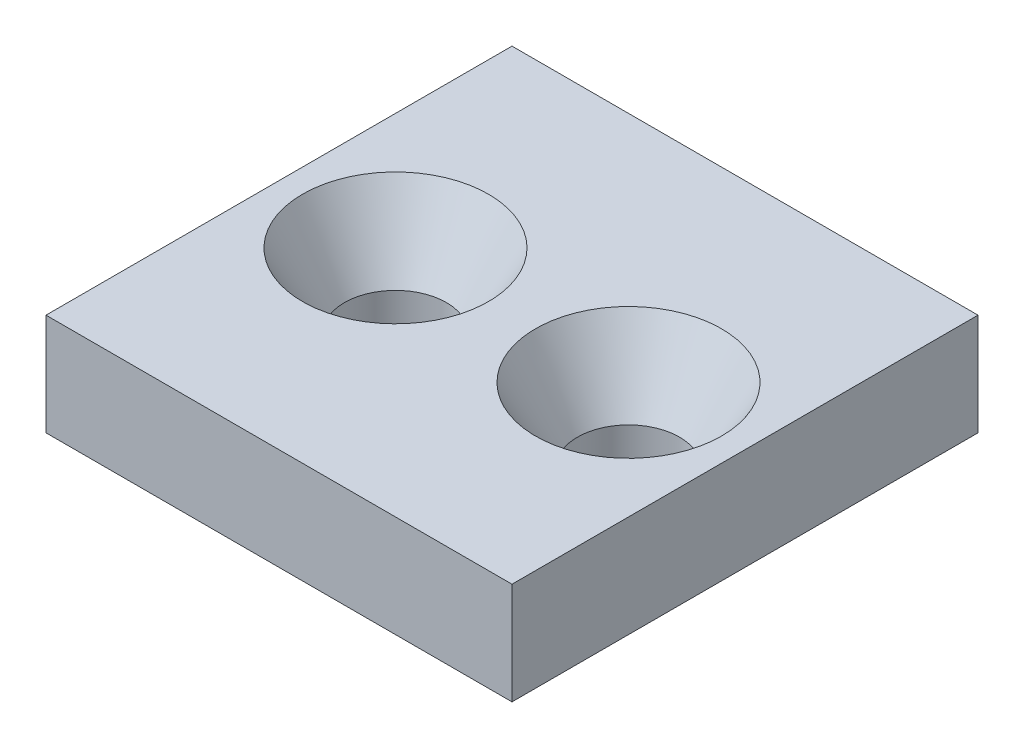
SolidWorks part; units mm, degrees
ref_plane "Front" through (0, 0, 0) normal (0, 0, 1) x (1, 0, 0)
ref_plane "Top" through (0, 0, 0) normal (0, 1, 0) x (1, 0, 0)
ref_plane "Right" through (0, 0, 0) normal (1, 0, 0) x (0, 0, -1)
sketch "Sketch1" plane through (0, 0, 0) normal (0, 1, 0) x (1, 0, 0)
  line L0 (16, -16) -> (-16, 16) construction
  line L1 (-16, 16) -> (16, 16)
  line L2 (-16, 16) -> (-16, -16)
  line L3 (-16, -16) -> (16, -16)
  line L4 (16, 16) -> (16, -16)
  dimension "D1" = 32
  dimension "D2" = 32
extrude "Extrude1" add sketch "Sketch1" along normal blind 7
sketch "Sketch2" plane through (0, 0, 0) normal (0, 0, 1) x (1, 0, 0)
  line L0 (-8, 9.9971) -> (-8, -4.187) construction
  line L1 (-16, 7) -> (-16, 0) construction
  line L2 (-14.3868, 7) -> (-11.5, 2)
  line L3 (-16, 7) -> (16, 7) construction
  line L4 (-11.5, 2) -> (-11.5, 0)
  line L5 (-16, 0) -> (16, 0) construction
  line L6 (-11.5, 0) -> (-8, 0)
  line L7 (-8, 0) -> (-8, 7)
  line L8 (-8, 7) -> (-14.3868, 7)
  dimension "D1" = 8
  dimension "D2" = 7
  dimension "D3" = 60
  dimension "D4" = 5
revolve "Cut-Revolve1" cut sketch "Sketch2" angle 360 about L0
mirror "Mirror1" about plane through (0, 0, 0) normal (1, 0, 0)
